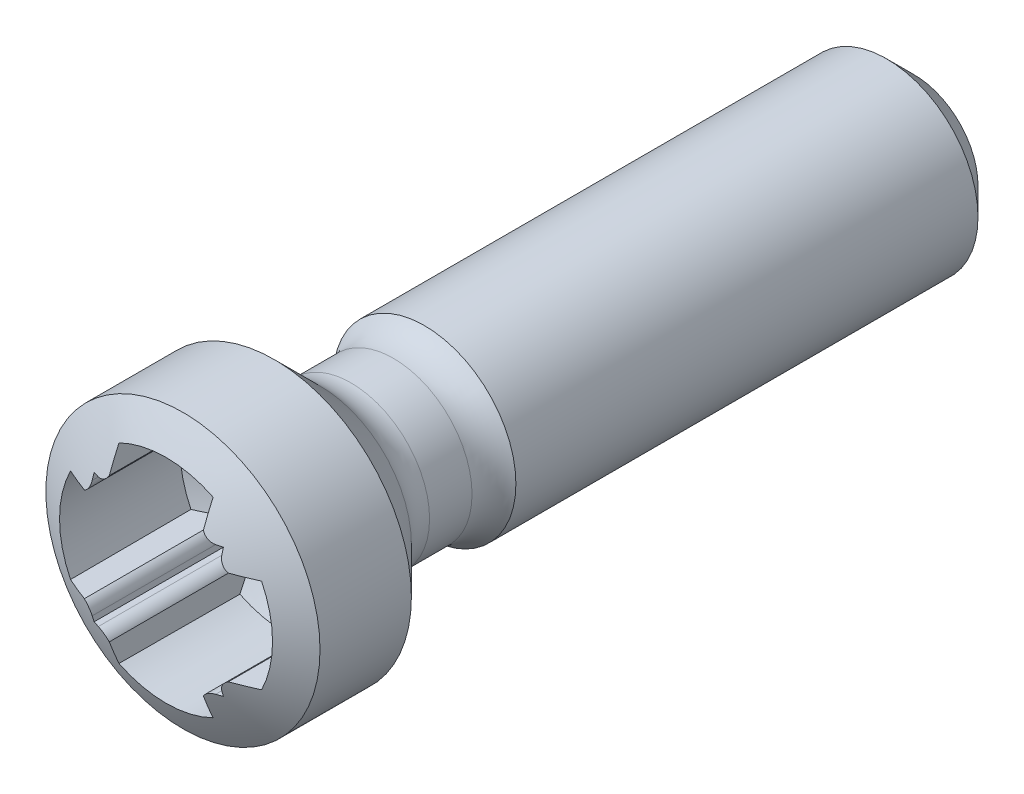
SolidWorks part; units mm, degrees
ref_plane "Plan1" through (0, 0, 0) normal (0, 0, 1) x (1, 0, 0)
ref_plane "Plan2" through (0, 0, 0) normal (0, 1, 0) x (1, 0, 0)
ref_plane "Plan3" through (0, 0, 0) normal (1, 0, 0) x (0, 0, -1)
imported_body "Importée1"
chamfer "Chanfrein1" distance 0.3 angle 45
